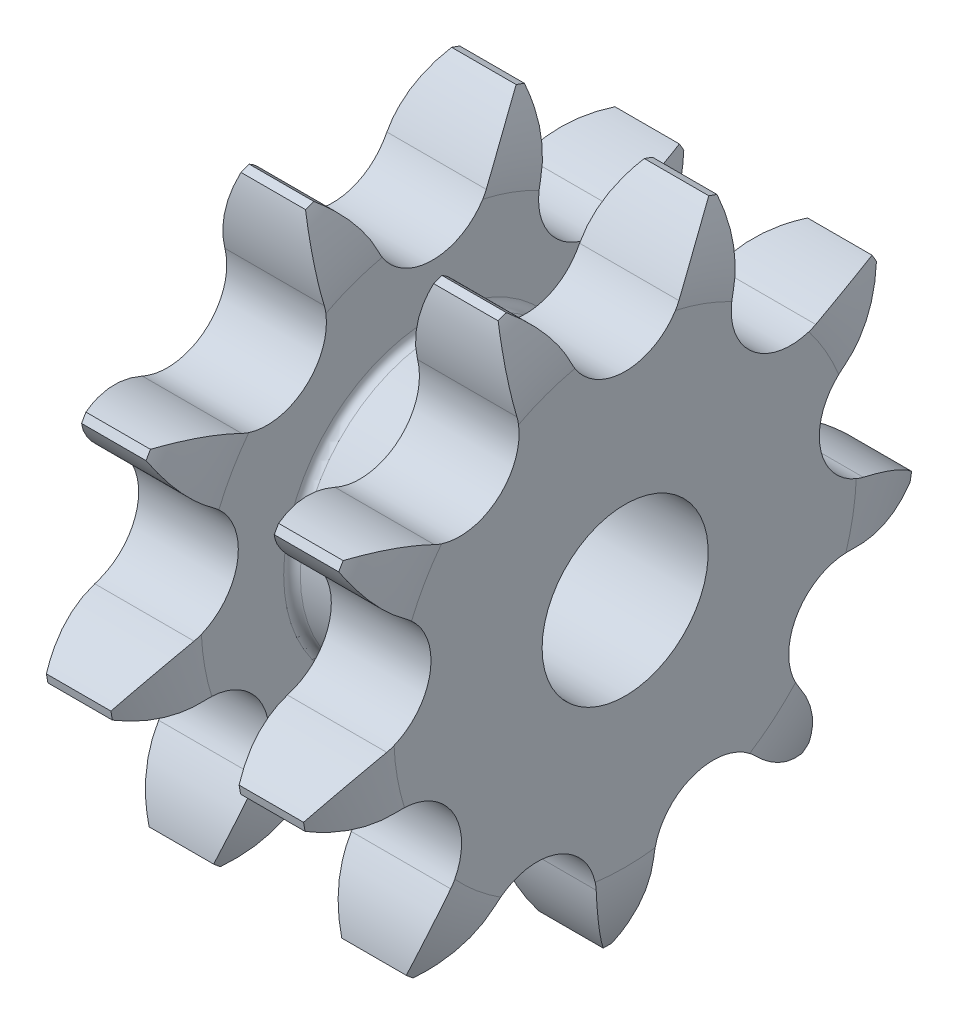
SolidWorks part; units mm, degrees
ref_plane "Plane1" through (0, 0, 0) normal (0, 0, 1) x (1, 0, 0)
ref_plane "Plane2" through (0, 0, 0) normal (0, 1, 0) x (1, 0, 0)
ref_plane "Plane3" through (0, 0, 0) normal (1, 0, 0) x (0, 0, -1)
sketch "Clipboard" plane through (0, 0, 0) normal (0, 1, 0) x (1, 0, 0)
  line L0 (0, 0) -> (12.5436, -1.9867)
  line L1 (-15, 0) -> (100, 0) construction
  line L2 (0, 0) -> (-0.8416, 0.9512)
  line L3 (0, 0) -> (-11.863, 4.5341)
  line L4 (0, 0) -> (3.0618, 0.4849)
  line L5 (0, 0) -> (-2.8109, -1.0484)
  line L6 (0, 0) -> (-17.5077, -11.8125)
  line L7 (-0.8416, 0.9512) -> (22.0505, 5.4009)
  line L8 (-76.2, 38.1) -> (-75.2, 38.1)
  line L9 (-73.4259, 41.6592) -> (-72.8306, 41.7344)
  line L10 (-73.4741, 12.7512) -> (-59.5541, 12.7512)
  circle A0 centre (0, 0) radius 4.255
  circle A1 centre (0, 0) radius 10.1515
  circle A2 centre (0, 0) radius 25
  dimension "Dr" = 8.51
  dimension "MHD" = 20.303
  dimension "Hub_dia" = 50
  dimension "Num_teeth" = 9
  dimension "Pitch" = 12.7
  dimension "Width" = 3.1
  dimension "Side_relief" = 1.27
  dimension "Side_radius" = 12.7
  dimension "Overall_len" = 3
  dimension "Show_teeth" = 9
  dimension "Thickness" = 21.12
  dimension "OAL" = 23.3205
  dimension "T_dim" = 1
  dimension "Fillet_rad" = 0.6
  dimension "Face_width" = 7.2
  dimension "Num_strands" = 2
  dimension "Transv_pitch" = 13.92
  dimension "Plate_wid" = 11.8
sketch "BasProSke" plane through (0, 0, 0) normal (0, 1, 0) x (1, 0, 0)
  line L0 (-10, 0) -> (60, 0) construction
  line L1 (0, 0) -> (0, 16.7129)
  line L2 (0, 0) -> (21.12, 0)
  line L3 (21.12, 0) -> (21.12, 16.7129)
  line L4 (19.85, 22.2487) -> (1.27, 22.2487)
  arc A0 (0, 16.7129) -> (1.27, 22.2487) centre (12.7, 16.7129) cw
  arc A1 (21.12, 16.7129) -> (19.85, 22.2487) centre (8.42, 16.7129) ccw
  dimension "D1" = 12.7
  dimension "G1" = 1.27
  dimension "G2" = 1.27
  dimension "Diameter" = 44.4973
  dimension "Thickness" = 21.12
revolve "Base-Revolve" add sketch "BasProSke" angle 360 about L0
sketch "GrvSke" plane through (0, 0, 0) normal (0, 1, 0) x (1, 0, 0)
  line L0 (7.2, 16.7129) -> (7.2, 10.7515)
  line L1 (7.8, 10.1515) -> (13.32, 10.1515)
  line L2 (13.92, 10.7515) -> (13.92, 16.7129)
  line L3 (5.93, 22.2487) -> (15.19, 22.2487)
  line L4 (10.56, 0) -> (10.56, 52.07) construction
  line L5 (-10, 0) -> (60, 0) construction
  line L6 (0, 0) -> (35.56, 0) construction
  arc A0 (13.92, 16.7129) -> (15.19, 22.2487) centre (26.62, 16.7129) cw
  arc A1 (7.2, 16.7129) -> (5.93, 22.2487) centre (-5.5, 16.7129) ccw
  arc A2 (7.2, 10.7515) -> (7.8, 10.1515) centre (7.8, 10.7515) ccw
  arc A3 (13.32, 10.1515) -> (13.92, 10.7515) centre (13.32, 10.7515) ccw
  dimension "D1" = 12.7
  dimension "Fillet_rad" = 0.6
  dimension "Diameter" = 44.4973
  dimension "Grv_diam" = 20.303
  dimension "Grv_width" = 6.72
  dimension "Offset" = 10.56
  dimension "G1" = 1.27
revolve "Groove" cut sketch "GrvSke" angle 360 about L6
sketch "TooCutSke" plane through (0, 0, 0) normal (1, 0, 0) x (0, 0, -1)
  line L0 (0, 18.6087) -> (3.8949, 16.7925) construction
  line L1 (0, 0) -> (0, 107) construction
  line L2 (0, 18.6087) -> (-10, 18.6087) construction
  line L3 (0, 18.6087) -> (-3.8949, 16.7925) construction
  arc A0 (3.8949, 16.7925) -> (7.8075, 21.3669) centre (14.0756, 12.0451) cw
  arc A1 (3.8949, 16.7925) -> (-3.8949, 16.7925) centre (0, 18.6087) cw
  arc A2 (-3.8949, 16.7925) -> (-7.8075, 21.3669) centre (-14.0756, 12.0451) ccw
  arc A3 (7.8075, 21.3669) -> (-7.8075, 21.3669) centre (0, 0) ccw
  dimension "R1" = 4.2976
  dimension "R2" = 11.2332
  dimension "Overcut" = 22.7487
  dimension "Seat_radius" = 18.6087
  dimension "X" = 130
extrude "ToothCut" cut sketch "TooCutSke" along normal through all
pattern_circular "TeethCuts" count 9 every 40 about axis through (-10, 0, 0) along (1, 0, 0) of "ToothCut"
sketch "HubNeaOneSke" plane through (0, 0, 0) normal (-1, 0, 0) x (0, 0, 1)
  circle A0 centre (0, 0) radius 10.1515
  dimension "Diameter" = 20.303
extrude "HubNearOne" [suppressed] add sketch "HubNeaOneSke" along normal blind 2.2005
fillet "HubNearOneFillet" [suppressed] radius 0.6
sketch "HubNeaBotSke" plane through (0, 0, 0) normal (-1, 0, 0) x (0, 0, 1)
  circle A0 centre (0, 0) radius 10.1515
  dimension "Diameter" = 20.303
extrude "HubNearBoth" [suppressed] add sketch "HubNeaBotSke" along normal blind 1.1003
fillet "HubNearBothFillet" [suppressed] radius 0.6
ref_plane "FarPln" through (21.12, 0, 0) normal (1, 0, 0) x (0, 0, -1)
sketch "HubFarSke" plane through (21.12, 0, 0) normal (1, 0, 0) x (0, 0, -1)
  circle A0 centre (0, 0) radius 10.1515
  dimension "Diameter" = 20.303
extrude "HubFar" [suppressed] add sketch "HubFarSke" along normal blind 1.1003
fillet "HubFarFillet" [suppressed] radius 0.6
sketch "BorSke" plane through (0, 0, 0) normal (1, 0, 0) x (0, 0, -1)
  circle A0 centre (0, 0) radius 6
  dimension "Diameter" = 12
extrude "Bore" cut sketch "BorSke" along normal mid plane 46.641
sketch "KeySke" plane through (0, 0, 0) normal (1, 0, 0) x (0, 0, -1)
  line L0 (-1, 0) -> (-1, 7)
  line L1 (-1, 7) -> (1, 7)
  line L2 (1, 7) -> (1, 0)
  line L3 (0, 0) -> (0, 34) construction
  line L4 (-1, 0) -> (1, 0)
  dimension "Offset" = 7
  dimension "Width" = 2
extrude "Keyway" [suppressed] cut sketch "KeySke" along normal mid plane 46.641
pattern_circular "Keyway2" [suppressed] count 2 every 90 about axis through (-10, 0, 0) along (1, 0, 0)
equation "' \"Pitch@Clipboard\" = 12.7"
equation "' \"Num_strands@Clipboard\" = 2"
equation "' \"Num_teeth@Clipboard\" = 9"
equation "' \"Hub_dia@Clipboard\" = 50"
equation "' \"Overall_len@Clipboard\" = 3"
equation "' \"Diameter@BorSke\" = 12"
equation "' \"T_dim@Clipboard\" = 1"
equation "' \"Width@KeySke\" = 2"
equation "' \"Dr@Clipboard\" = 8.51"
equation "' \"Face_width@Clipboard\" = 7.2"
equation "' \"Side_radius@Clipboard\" = 12.7"
equation "' \"Side_relief@Clipboard\" = 1.27"
equation "' \"Transv_pitch@Clipboard\" = 13.92"
equation "' \"Show_teeth@Clipboard\" = 9"
equation "' \"Fillet_rad@Clipboard\" = 0.6"
equation "' \"Plate_wid@Clipboard\" = 11.8"
equation "\"Num_teeth@Clipboard\" = int( \"Num_teeth@Clipboard\" )"
equation "\"Num_teeth@Clipboard\" = ((sgn( \"Num_teeth@Clipboard\" - 5.0)+1)*( \"Num_teeth@Clipboard\" - 5.0))/2 +5.0"
equation "\"Num_teeth@Clipboard\" = ((sgn( \"Num_teeth@Clipboard\" - 200.0)-1)*( \"Num_teeth@Clipboard\" - 200.0))/-2 +200.0"
equation "\"MHD@Clipboard\" = \"Pitch@Clipboard\" * (1.0 / tan(3.14159265 / \"Num_teeth@Clipboard\" )) - 1.05 * \"Plate_wid@Clipboard\" - 2.0 * \"Fillet_rad@Clipboard\" - 1.0"
equation "\"Thickness@Clipboard\"  = \"Face_width@Clipboard\" + (\"Num_strands@Clipboard\" - 1) * \"Transv_pitch@Clipboard\""
equation "\"OAL@Clipboard\" = \"Thickness@Clipboard\" + 2 * \"Fillet_rad@Clipboard\" + 1"
equation "\"MHD@Clipboard\" = ((sgn( \"MHD@Clipboard\" - \"Hub_dia@Clipboard\" )-1)*( \"MHD@Clipboard\" - \"Hub_dia@Clipboard\" ))/-2+ \"Hub_dia@Clipboard\""
equation "\"OAL@Clipboard\" = ((sgn( \"OAL@Clipboard\" - \"Overall_len@Clipboard\" )+1)*( \"OAL@Clipboard\" - \"Overall_len@Clipboard\" ))/2 + \"Overall_len@Clipboard\" + 0.0005"
equation "\"Num_teeth@TeethCuts\" = int( \"Show_teeth@Clipboard\" ) + 1"
equation "\"Num_teeth@TeethCuts\" = ((sgn( \"Num_teeth@TeethCuts\" - \"Num_teeth@Clipboard\" )-1)*( \"Num_teeth@TeethCuts\" - \"Num_teeth@Clipboard\" ))/-2+ \"Num_teeth@Clipboard\""
equation "\"Num_teeth@TeethCuts\" = ((sgn( \"Num_teeth@TeethCuts\" - 2.0)+1)*( \"Num_teeth@TeethCuts\" - 2.0))/2 +2.0"
equation "\"Angle@TeethCuts\" = 360.0 / \"Num_teeth@Clipboard\""
equation "\"Seat_radius@TooCutSke\" = ( \"Pitch@Clipboard\" / 2.0) / sin(3.14159265 / \"Num_teeth@Clipboard\" ) - \"Dr@Clipboard\" / 2.0 + \"Dr@Clipboard\" * 0.505"
equation "\"R1@TooCutSke\"  = \"Dr@Clipboard\" * 0.505"
equation "\"X@TooCutSke\" = 140.0 - (90.0 / \"Num_teeth@Clipboard\")"
equation "\"R2@TooCutSke\" = 0.12 * \"Dr@Clipboard\" * ( \"Num_teeth@Clipboard\" + 2.0)"
equation "\"Overcut@TooCutSke\" = 0.5 + 0.625 * \"Pitch@Clipboard\" - 0.5 * \"Dr@Clipboard\"  +  \"Pitch@Clipboard\" / 2.0 / sin(3.14159265 / \"Num_teeth@Clipboard\" )"
equation "\"Diameter@BasProSke\" = 2.0 * ( 0.625 * \"Pitch@Clipboard\" - 0.5 * \"Dr@Clipboard\"  +  \"Pitch@Clipboard\" / 2.0 / sin(3.14159265 / \"Num_teeth@Clipboard\" ))"
equation "\"Thickness@BasProSke\"  = \"Thickness@Clipboard\""
equation "\"G1@BasProSke\" =  \"Side_relief@Clipboard\""
equation "\"G2@BasProSke\" =  \"Side_relief@Clipboard\""
equation "\"D1@BasProSke\" =  \"Side_radius@Clipboard\""
equation "\"Diameter@GrvSke\" = \"Diameter@BasProSke\""
equation "\"G1@GrvSke\" = \"Side_relief@Clipboard\""
equation "\"D1@GrvSke\" = \"Side_radius@Clipboard\""
equation "\"Grv_diam@GrvSke\" =  \"Pitch@Clipboard\" * (1.0 / tan(3.14159265 / \"Num_teeth@Clipboard\" ))- 1.05 * \"Plate_wid@Clipboard\" - 2.0 * \"Fillet_rad@Clipboard\" - 1.0"
equation "\"Grv_width@GrvSke\" =  \"Transv_pitch@Clipboard\" - \"Face_width@Clipboard\""
equation "\"Offset@GrvSke\" = \"Grv_width@GrvSke\" / 2.0 + \"Face_width@Clipboard\""
equation "\"Fillet_rad@GrvSke\" = \"Fillet_rad@Clipboard\""
equation "\"Diameter@HubNeaOneSke\" = \"MHD@Clipboard\""
equation "\"Length@HubNearOne\" = \"OAL@Clipboard\" - \"Thickness@BasProSke\""
equation "\"Diameter@HubNeaBotSke\" = \"MHD@Clipboard\""
equation "\"Length@HubNearBoth\" = ( \"OAL@Clipboard\" - \"Thickness@BasProSke\" ) / 2.0"
equation "\"D1@HubNearOneFillet\" = \"Fillet_rad@Clipboard\""
equation "\"D1@HubNearBothFillet\" = \"Fillet_rad@Clipboard\""
equation "\"Thickness@FarPln\" = \"Thickness@BasProSke\""
equation "\"Diameter@HubFarSke\" = \"MHD@Clipboard\""
equation "\"Length@HubFar\" = ( \"OAL@Clipboard\" - \"Thickness@BasProSke\" ) / 2.0"
equation "\"D1@HubFarFillet\" = \"Fillet_rad@Clipboard\""
equation "\"D1@Bore\" = \"OAL@Clipboard\" * 2.0"
equation "\"D1@Keyway\" = \"OAL@Clipboard\" * 2.0"
equation "\"Offset@KeySke\" = \"T_dim@Clipboard\" + \"Diameter@BorSke\" / 2.0"
